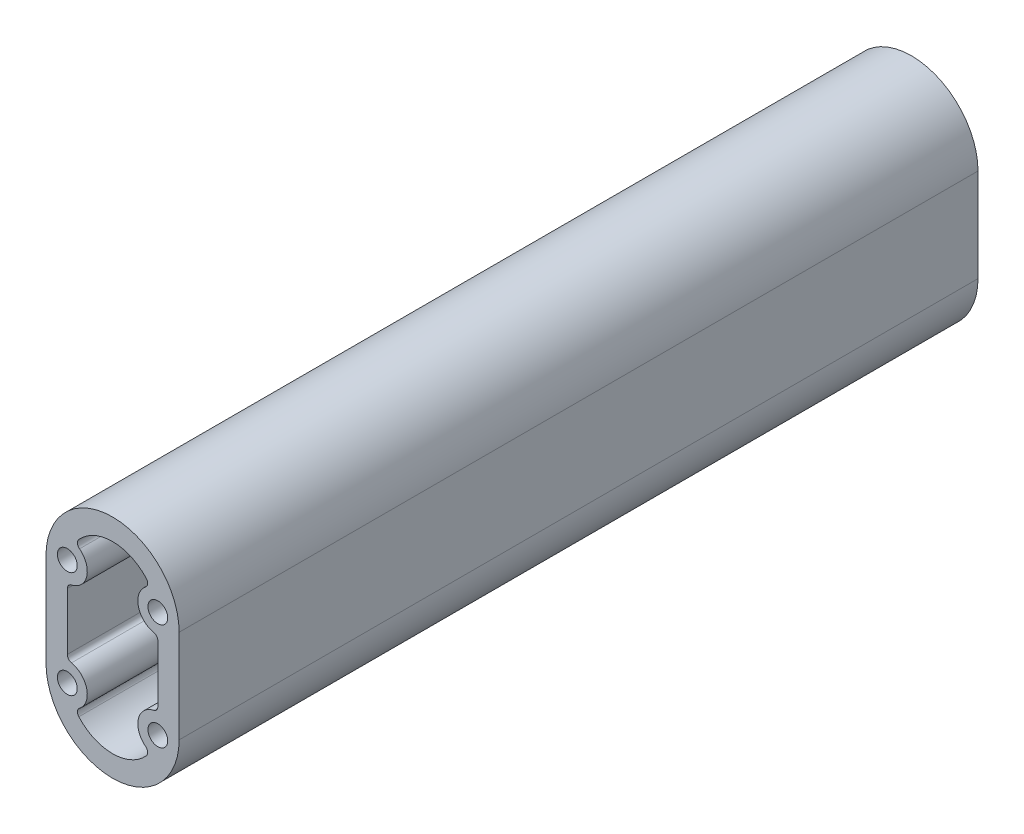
SolidWorks part; units mm, degrees
ref_plane "Vorderansicht" through (0, 0, 0) normal (0, 0, 1) x (1, 0, 0)
ref_plane "Draufsicht" through (0, 0, 0) normal (0, 1, 0) x (1, 0, 0)
ref_plane "Seitenansicht" through (0, 0, 0) normal (1, 0, 0) x (0, 0, -1)
sketch "Skizze1" plane through (0, 0, 0) normal (0, 0, 1) x (1, 0, 0)
  line L0 (25, -17.5) -> (25, 17.5)
  line L1 (-25, 17.5) -> (-25, -17.5)
  line L2 (-17, 10.713) -> (-17, -10.713)
  line L3 (17, -10.713) -> (17, 10.7131)
  line L4 (0, 42.5) -> (0, -42.5) construction
  line L5 (-25, 0) -> (25, 0) construction
  arc A0 (15.4211, -12.6682) -> (12.4019, -25.9251) centre (17, -20) ccw
  arc A1 (-12.4019, -25.9251) -> (-15.4211, -12.6682) centre (-17, -20) ccw
  circle A2 centre (17, -20) radius 3.725
  arc A3 (-25, -17.5) -> (25, -17.5) centre (0, -17.5) ccw
  circle A4 centre (-17, -20) radius 3.725
  arc A5 (12.6659, -28.8391) -> (12.4019, -25.9251) centre (11.1758, -27.5051) ccw
  arc A6 (-12.6659, -28.8391) -> (12.6659, -28.8391) centre (0, -17.5) ccw
  arc A7 (-12.4019, -25.9251) -> (-12.6659, -28.8391) centre (-11.1758, -27.5051) ccw
  circle A8 centre (17, 20) radius 3.725
  arc A9 (15.4211, -12.6682) -> (17, -10.713) centre (15, -10.713) ccw
  arc A10 (17, 10.7131) -> (15.4212, 12.6683) centre (15, 10.7131) ccw
  arc A11 (25, 17.5) -> (-25, 17.5) centre (0, 17.5) ccw
  circle A13 centre (-17, 20) radius 3.725
  arc A14 (-17, -10.713) -> (-15.4211, -12.6682) centre (-15, -10.713) ccw
  arc A15 (-15.4211, 12.6682) -> (-17, 10.713) centre (-15, 10.713) ccw
  arc A16 (-15.4211, 12.6682) -> (-12.4019, 25.9251) centre (-17, 20) ccw
  arc A17 (-12.6659, 28.8391) -> (-12.4019, 25.9251) centre (-11.1758, 27.5051) ccw
  arc A18 (12.6662, 28.8388) -> (-12.6659, 28.8391) centre (0, 17.5) ccw
  arc A19 (12.4023, 25.9248) -> (12.6662, 28.8388) centre (11.1761, 27.5048) ccw
  arc A20 (12.4023, 25.9248) -> (15.4212, 12.6683) centre (17.0007, 20) ccw
  dimension "D1" = 7.45
  dimension "D3" = 85
  dimension "D4" = 2
  dimension "D5" = 17
  dimension "D6" = 2
  dimension "D10" = 30
  dimension "D11" = 22.3515
  dimension "D2" = 50
  dimension "D7" = 34
  dimension "D8" = 40
  dimension "D9" = 34
  dimension "D12" = 12.4023
extrude "Linear austragen1" add sketch "Skizze1" along normal blind 300
